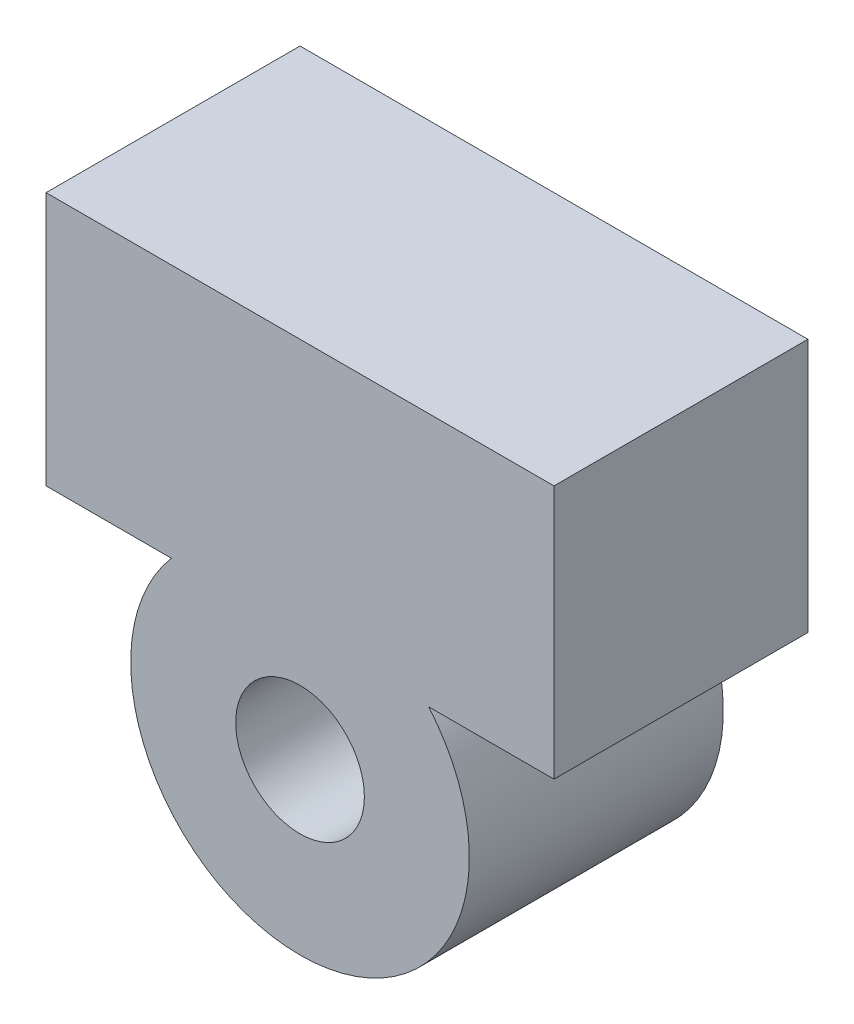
SolidWorks part; units mm, degrees
ref_plane "Alzado" through (0, 0, 0) normal (0, 0, 1) x (1, 0, 0)
ref_plane "Planta" through (0, 0, 0) normal (0, 1, 0) x (1, 0, 0)
ref_plane "Vista lateral" through (0, 0, 0) normal (1, 0, 0) x (0, 0, -1)
sketch "Croquis1" plane through (0, 0, 0) normal (0, 0, 1) x (1, 0, 0)
  line L0 (-15.1987, 13) -> (-30.0013, 13)
  line L1 (-30.0013, 13) -> (-30.0013, 43)
  line L2 (-30.0013, 43) -> (29.9987, 43)
  line L3 (29.9987, 43) -> (29.9987, 13)
  line L4 (29.9987, 13) -> (15.1987, 13)
  arc A0 (-15.1987, 13) -> (15.1987, 13) centre (0, 0) ccw
  dimension "D1" = 40
  dimension "D2" = 60
  dimension "D3" = 13
  dimension "D4" = 13
  dimension "D6" = 30
  dimension "D7" = 14.8
extrude "Saliente-Extruir1" add sketch "Croquis1" along normal blind 30
sketch "Croquis2" plane through (0, 0, 30) normal (0, 0, 1) x (1, 0, 0)
  circle A0 centre (0, 0) radius 7.6
  dimension "D1" = 15.2
extrude "Cortar-Extruir1" cut sketch "Croquis2" against normal through all
